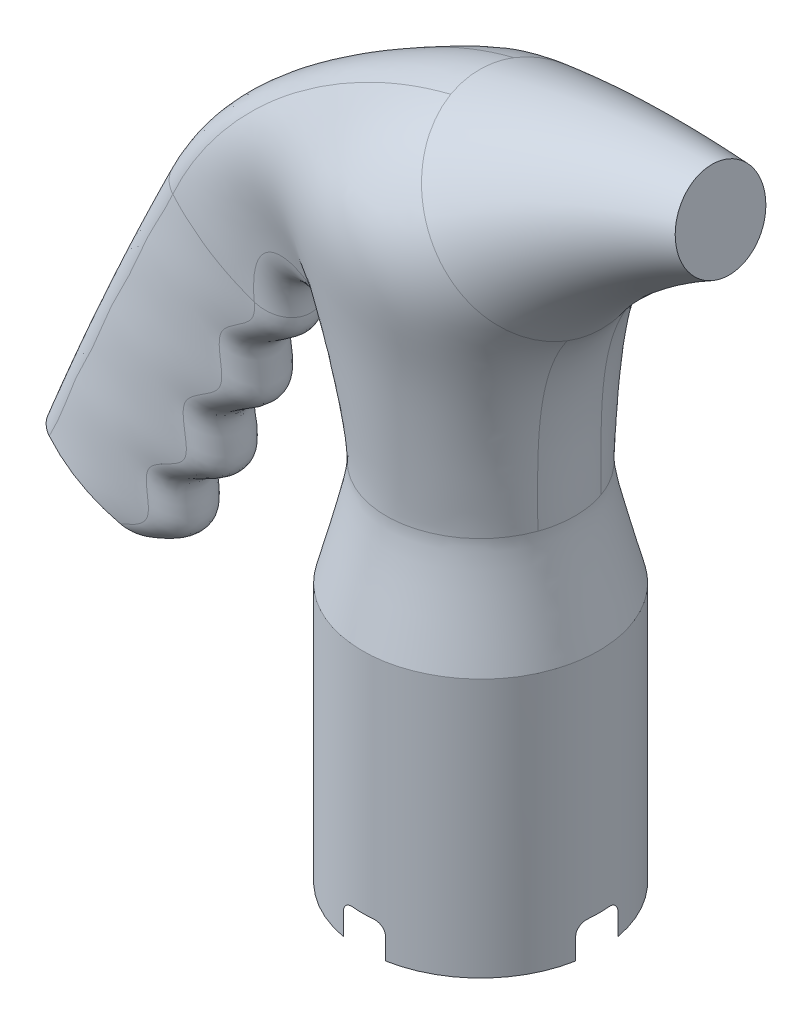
SolidWorks part; units mm, degrees
ref_plane "Front" through (0, 0, 0) normal (0, 0, 1) x (1, 0, 0)
ref_plane "Top" through (0, 0, 0) normal (0, 1, 0) x (1, 0, 0)
ref_plane "Right" through (0, 0, 0) normal (1, 0, 0) x (0, 0, -1)
sketch "Sketch1" plane through (0, 0, 0) normal (0, 0, 1) x (1, 0, 0)
  line L0 (69.5379, 161.1481) -> (74.675, 134.8913)
  line L1 (-91.3555, -15.0855) -> (-127.255, 0.1529)
  line L2 (39.116, 0) -> (-39.116, 0)
  line L3 (39.116, 0) -> (28.3554, 49)
  line L4 (-39.116, 0) -> (-28.3554, 49)
  line L5 (-0.3725, 150.8603) -> (32.3611, 95.6993) construction
  arc A1 (-55.5491, 64.4595) -> (-91.3555, -15.0855) centre (984.4903, -451.5356) ccw
  arc A3 (-90.2031, 82.3504) -> (-127.255, 0.1529) centre (984.4903, -451.5356) ccw
  spline S3 degree 3 poles (74.675, 134.8913) (73.46, 134.2304) (71.0261, 132.9066) (66.801, 130.3553) (61.5448, 126.8589) (55.9263, 122.5631) (50.1837, 117.5458) (45.227, 112.5972) (40.2616, 106.9296) (36.7169, 102.2761) (34.0279, 98.3457) (32.9166, 96.5814) (32.3611, 95.6993) knots 0 0 0 0 0.069056 0.138329 0.247578 0.387221 0.497333 0.637836 0.748433 0.889305 0.944659 1 1 1 1
  spline S4 degree 3 poles (32.3611, 95.6993) (24.4059, 83.0682) (25.4349, 64.1064) (28.3554, 49) knots 0 0 0 0 1 1 1 1 weights 1 1 0.950704 0.950704
  spline S8 degree 3 number of poles 73 (-55.5491, 64.4595) -> (-40.5032, 75.1971)
  spline S9 degree 3 poles (-40.5032, 75.1971) (-40.3843, 75.1961) (-40.1466, 75.1941) (-39.7908, 75.1782) (-39.436, 75.1527) (-39.0825, 75.1167) (-38.7306, 75.0704) (-38.3803, 75.0136) (-38.0319, 74.9463) (-37.6856, 74.8685) (-37.3416, 74.7801) (-37.0001, 74.681) (-36.6613, 74.5713) (-36.3257, 74.451) (-35.9939, 74.3203) (-35.6666, 74.1794) (-35.344, 74.0284) (-35.0261, 73.8673) (-34.7132, 73.6964) (-34.4053, 73.5155) (-34.1027, 73.3248) (-33.8053, 73.1244) (-33.5134, 72.9144) (-33.227, 72.6947) (-32.9463, 72.4654) (-32.6714, 72.2267) (-32.4023, 71.9785) (-31.6324, 71.2247) (-30.4776, 69.7996) (-29.2399, 67.5392) (-28.3881, 65.1826) (-27.9832, 63.4272) (-27.7989, 62.3464) (-27.7255, 61.8577) (-27.6622, 61.3738) (-27.6083, 60.8953) (-27.5633, 60.423) (-27.5263, 59.9528) (-27.4951, 59.4566) (-27.4694, 58.9011) (-27.4516, 58.2557) (-27.4464, 57.512) (-27.4596, 56.6641) (-27.4977, 55.7051) (-27.5681, 54.6275) (-27.6792, 53.4223) (-27.8411, 52.08) (-28.0613, 50.5886) (-28.2539, 49.5481) (-28.3554, 49) knots 0 0 0 0 0.010741 0.021463 0.032169 0.042863 0.053548 0.064229 0.074908 0.085591 0.096281 0.106984 0.117704 0.128444 0.139178 0.149904 0.160625 0.171349 0.182081 0.192827 0.203593 0.214385 0.22521 0.236073 0.246981 0.25794 0.268956 0.280037 0.355252 0.433482 0.51175 0.580838 0.595891 0.610773 0.62547 0.63997 0.654259 0.668322 0.682565 0.699166 0.71855 0.740876 0.766332 0.795137 0.827547 0.863864 0.904432 0.949656 1 1 1 1
  spline S12 degree 3 poles (-0.3725, 150.8603) (0.9525, 151.213) (3.6029, 151.9185) (9.6064, 153.4062) (16.8956, 155.0345) (26.1418, 156.8036) (34.6018, 158.1614) (43.6705, 159.3435) (51.948, 160.1788) (59.2226, 160.7005) (64.8511, 160.9954) (67.9773, 161.0973) (69.5379, 161.1481) knots 0 0 0 0 0.055341 0.110695 0.251567 0.362164 0.502667 0.612779 0.752422 0.861671 0.930944 1 1 1 1
  spline S13 degree 3 poles (-0.3725, 150.8603) (-74.4815, 131.1326) (-74.14, 114.6847) (-90.2031, 82.3504) knots 0 0 0 0 1 1 1 1 weights 1 1 0.635412 0.635412
  dimension "D1" = 78.232
  dimension "D2" = 161.1481
  dimension "D3" = 38.9998
  dimension "D4" = 77.614
  dimension "D5" = 26.7547
ref_plane "Plane1" through (0, 49, 0) normal (0, 1, 0) x (-1, 0, 0)
ref_plane "Plane2" through (97.3403, 19.0445, 0) normal (-0.9814, -0.192, 0) x (0, 0, 1)
ref_plane "Plane3" through (-19.3731, -45.6402, 0) normal (0.3907, 0.9205, 0) x (-0.9205, 0.3907, 0)
ref_plane "Plane4" through (65.9329, 39.1258, 0) normal (-0.86, -0.5103, 0) x (0, 0, 1)
sketch "Sketch2" plane through (0, 0, 0) normal (0, 1, 0) x (1, 0, 0)
  circle A0 centre (0, 0) radius 39
  dimension "D1" = 78
sketch "Sketch3" plane through (0, 49, 0) normal (0, 1, 0) x (-1, 0, 0)
  circle A0 centre (0, 0) radius 28.3554
sketch "Sketch4" plane through (0, 0, 0) normal (0, 0, 1) x (1, 0, 0)
  arc A0 (-90.2031, 82.3504) -> (-127.255, 0.1529) centre (984.4903, -451.5356) ccw construction
  arc A1 (-90.2031, 82.3504) -> (-127.255, 0.1529) centre (984.4903, -451.5356) ccw
sketch "Sketch5" plane through (0, 0, 0) normal (0, 0, 1) x (1, 0, 0)
  line L0 (-52.9349, 70.0663) -> (-55.6234, 85.3135) construction
  line L1 (-52.9349, 70.0663) -> (-52.9349, 87.7838) construction
  spline_without_curve S0
  dimension "D1" = 10
sketch "Sketch6" plane through (-19.3731, -45.6402, 0) normal (0.3907, 0.9205, 0) x (-0.9205, 0.3907, 0)
  line L1 (78.1814, 0) -> (117.1986, 0) construction
  arc A0 (86.3452, -9.4272) -> (86.3452, 9.4272) centre (87.7064, 0) cw
  arc A1 (111.9269, -7.2491) -> (111.9269, 7.2491) centre (109.5786, 0) ccw
  arc A2 (86.3452, 9.4272) -> (111.9269, 7.2491) centre (94.4498, -46.7009) cw
  arc A3 (86.3452, -9.4272) -> (111.9269, -7.2491) centre (94.4498, 46.7009) ccw
  dimension "D2" = 7.62
  dimension "D3" = 9.525
  dimension "D1" = 20.0187
sketch "Sketch7" plane through (0, 0, 0) normal (0, 0, 1) x (1, 0, 0)
  spline S0 degree 3 poles (74.675, 134.8913) (73.46, 134.2304) (71.0261, 132.9066) (66.801, 130.3553) (61.5448, 126.8589) (55.9263, 122.5631) (50.1837, 117.5458) (45.227, 112.5972) (40.2616, 106.9296) (36.7169, 102.2761) (34.0279, 98.3457) (32.9166, 96.5814) (32.3611, 95.6993) knots 0 0 0 0 0.069056 0.138329 0.247578 0.387221 0.497333 0.637836 0.748433 0.889305 0.944659 1 1 1 1 construction
  spline S1 degree 3 poles (74.675, 134.8913) (73.46, 134.2304) (71.0261, 132.9066) (66.801, 130.3553) (61.5448, 126.8589) (55.9263, 122.5631) (50.1837, 117.5458) (45.227, 112.5972) (40.2616, 106.9296) (36.7169, 102.2761) (34.0279, 98.3457) (32.9166, 96.5814) (32.3611, 95.6993) knots 0 0 0 0 0.069056 0.138329 0.247578 0.387221 0.497333 0.637836 0.748433 0.889305 0.944659 1 1 1 1
sketch "Sketch8" plane through (0, 0, 0) normal (0, 0, 1) x (1, 0, 0)
  spline S0 degree 3 poles (-0.3725, 150.8603) (0.9525, 151.213) (3.6029, 151.9185) (9.6064, 153.4062) (16.8956, 155.0345) (26.1418, 156.8036) (34.6018, 158.1614) (43.6705, 159.3435) (51.948, 160.1788) (59.2226, 160.7005) (64.8511, 160.9954) (67.9773, 161.0973) (69.5379, 161.1481) knots 0 0 0 0 0.055341 0.110695 0.251567 0.362164 0.502667 0.612779 0.752422 0.861671 0.930944 1 1 1 1 construction
  spline S1 degree 3 poles (-0.3725, 150.8603) (0.9525, 151.213) (3.6029, 151.9185) (9.6064, 153.4062) (16.8956, 155.0345) (26.1418, 156.8036) (34.6018, 158.1614) (43.6705, 159.3435) (51.948, 160.1788) (59.2226, 160.7005) (64.8511, 160.9954) (67.9773, 161.0973) (69.5379, 161.1481) knots 0 0 0 0 0.055341 0.110695 0.251567 0.362164 0.502667 0.612779 0.752422 0.861671 0.930944 1 1 1 1
sketch "Sketch9" plane through (97.3403, 19.0445, 0) normal (-0.9814, -0.192, 0) x (0, 0, 1)
  line L0 (-13.3773, 131.4205) -> (0, 144.7979) construction
  line L1 (0, 144.7979) -> (0, 118.0432) construction
  ellipse E0 centre (0, 131.4205) end of major axis (13.3773, 131.4205) minor radius 13.3773
  dimension "D1" = 45
sketch "Sketch10" plane through (0, 0, 0) normal (1, 0, 0) x (0, 0, -1)
  line L0 (0, 173.7086) -> (0, -18.1254) construction
  line L1 (-9.525, 173.7086) -> (9.525, 173.7086)
  line L2 (-9.525, 173.7086) -> (-9.525, -18.1254)
  line L3 (-9.525, -18.1254) -> (9.525, -18.1254)
  line L4 (9.525, 173.7086) -> (9.525, -18.1254)
  dimension "D1" = 19.05
sketch "Sketch11" plane through (0, 0, 0) normal (1, 0, 0) x (0, 0, -1)
  line L0 (0, 173.7086) -> (0, -18.1254) construction
  line L1 (-9.525, 173.7086) -> (9.525, 173.7086)
  line L2 (-9.525, 173.7086) -> (-9.525, -18.1254)
  line L3 (-9.525, -18.1254) -> (9.525, -18.1254)
  line L4 (9.525, 173.7086) -> (9.525, -18.1254)
  dimension "D1" = 19.05
sketch "Pull Point1" plane through (0, 0, 0) normal (1, 0, 0) x (0, 0, -1)
  line L0 (0, 213.1653) -> (0, -65.6451) construction
  point P4 (32, 90.5097)
  dimension "D3" = 32
  dimension "D4" = 96
sketch "Pull Point2" plane through (0, 0, 0) normal (1, 0, 0) x (0, 0, -1)
  point P1 (-32, 90.5097)
sketch "Sketch13" plane through (0, 0, 0) normal (0, 0, 1) x (1, 0, 0)
  line L0 (0, 114.1299) -> (0, -144.7009) construction
  line L1 (0, 173.7086) -> (0, -18.1254) construction
  line L3 (35.5, 38) -> (35.5, -54)
  dimension "D1" = 35.5
  dimension "D2" = 35.5
  dimension "D3" = 92
sketch "Sketch14" plane through (0, 0, 0) normal (1, 0, 0) x (0, 0, -1)
  line L0 (-80.976, -63.5) -> (86.5606, -63.5) construction
  line L1 (0, 185.2035) -> (0, -91.2319) construction
  line L2 (0, 114.1299) -> (0, -144.7009) construction
  line L3 (-6.35, -63.5) -> (-6.35, -53.975)
  line L4 (6.35, -63.5) -> (6.35, -53.975)
  line L5 (-3.175, -50.8) -> (3.175, -50.8)
  arc A0 (-6.35, -53.975) -> (-3.175, -50.8) centre (-3.175, -53.975) cw
  arc A1 (6.35, -53.975) -> (3.175, -50.8) centre (3.175, -53.975) ccw
  point P13 (-6.35, -50.8)
  point P16 (6.35, -50.8)
  dimension "D3" = 3.175
  dimension "D4" = 3.175
  dimension "D1" = 63.5
  dimension "D2" = 12.7
  dimension "D5" = 12.7
surface "Surface-Loft1"
surface "Surface-Sweep1"
surface "Surface-Sweep2"
surface "Surface-Loft2"
surface "Surface-Loft3"
surface "Surface-Loft4"
surface "Surface-Knit1"
surface "Surface-Fill1"
surface "Surface-Fill3"
surface "Surface-Plane1"
surface "Surface-Plane2"
surface "Surface-Knit2"
surface "Surface-Revolve1" sketch "Sketch13" parameters "D1"=360
move or copy body "Body-Move/Copy1" bodies to move or copy 284
surface "Surface-Trim1"
surface "Surface-Extrude1" sketch "Sketch14" parameters "D1"=140
move or copy body "Body-Move/Copy2" bodies to move or copy 287
surface "Surface-Trim7"
surface "Surface-Trim8"
delete or keep bodies "Body-Delete1" type delete bodies bodies 287 288
surface "Surface-Untrim1" parameters "D3"=0.1905
